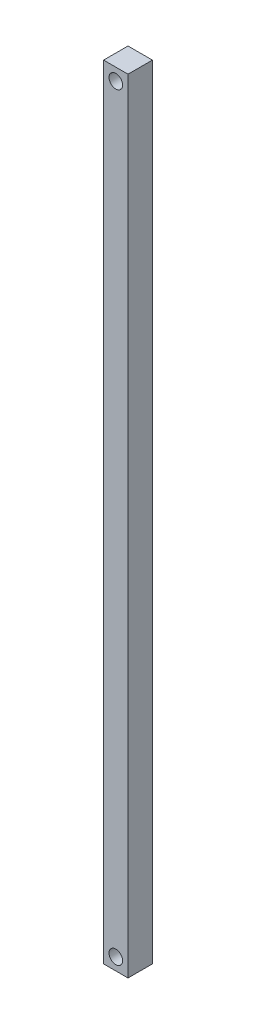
SolidWorks part; units mm, degrees
ref_plane "Front Plane" through (0, 0, 0) normal (0, 0, 1) x (1, 0, 0)
ref_plane "Top Plane" through (0, 0, 0) normal (0, 1, 0) x (1, 0, 0)
ref_plane "Right Plane" through (0, 0, 0) normal (1, 0, 0) x (0, 0, -1)
sketch "Sketch1" plane through (0, 0, 0) normal (0, 0, 1) x (1, 0, 0)
  line L0 (55, 0) -> (-55, 0) construction
  line L1 (-3.7697, 0) -> (14.9303, 0)
  line L2 (-3.7697, 0) -> (-3.7697, 600)
  line L3 (-3.7697, 600) -> (14.9303, 600)
  line L4 (14.9303, 0) -> (14.9303, 600)
  line L5 (5.5803, 600) -> (5.5803, 0) construction
  circle A0 centre (5.5803, 590.65) radius 5.2
  circle A1 centre (5.5803, 9.35) radius 5.2
  dimension "D3" = 10.4
  dimension "D1" = 18.7
  dimension "D2" = 600
  dimension "D4" = 9.35
  dimension "D6" = 9.35
extrude "Boss-Extrude1" add sketch "Sketch1" along normal blind 18.7
